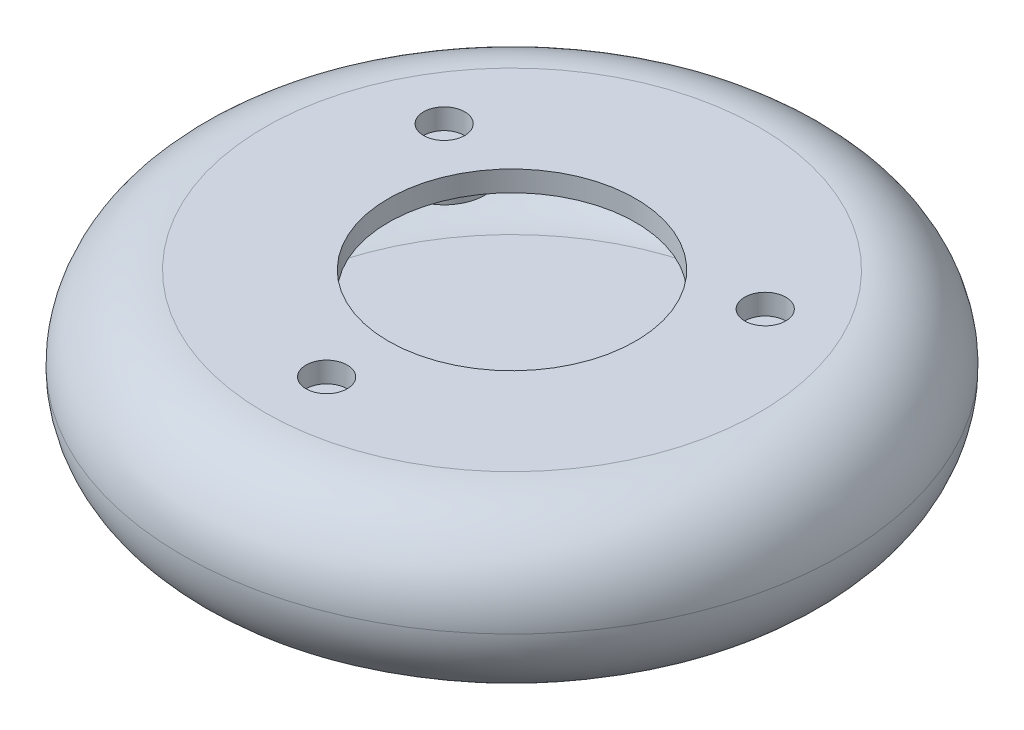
SolidWorks part; units mm, degrees
ref_plane "Alzado" through (0, 0, 0) normal (0, 0, 1) x (1, 0, 0)
ref_plane "Planta" through (0, 0, 0) normal (0, 1, 0) x (1, 0, 0)
ref_plane "Vista lateral" through (0, 0, 0) normal (1, 0, 0) x (0, 0, -1)
sketch "Croquis1" plane through (0, 0, 0) normal (0, 1, 0) x (1, 0, 0)
  circle A0 centre (0, 0) radius 80
  dimension "D1" = 160
extrude "Saliente-Extruir1" add sketch "Croquis1" along normal blind 40
fillet "Redondeo1" radius 20 2 edges at (0, 0, 80) (0, 40, 80)
sketch "Croquis2" plane through (0, 40, 0) normal (0, 1, 0) x (1, 0, 0)
  line L1 (0, -45) -> (38.9711, 22.5) construction
  line L2 (38.9711, 22.5) -> (-38.9711, 22.5) construction
  line L3 (-38.9711, 22.5) -> (0, -45) construction
  circle A0 centre (0, 0) radius 30
  circle A1 centre (0, 0) radius 22.5 construction
  circle A2 centre (0, 0) radius 45 construction
  circle A3 centre (0, -45) radius 5
  circle A4 centre (-38.9711, 22.5) radius 5
  circle A5 centre (38.9711, 22.5) radius 5
  dimension "D1" = 60
  dimension "D2" = 90
extrude "Cortar-Extruir1" cut sketch "Croquis2" against normal blind 5
shell "Vaciado1" thickness 5
sketch "Croquis3" plane through (0, 0, 0) normal (0, -1, 0) x (1, 0, 0)
  circle A0 centre (0, 0) radius 5
extrude "Cortar-Extruir2" cut sketch "Croquis3" against normal blind 5
